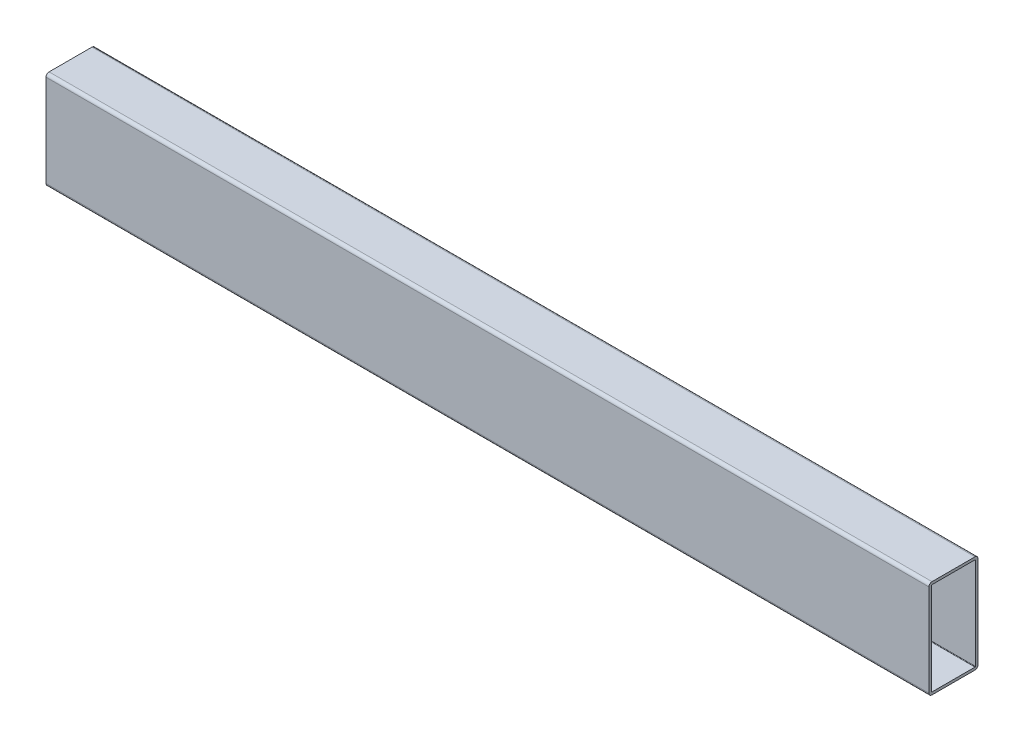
SolidWorks part; units mm, degrees
ref_plane "Front Plane" through (0, 0, 0) normal (0, 0, 1) x (1, 0, 0)
ref_plane "Top Plane" through (0, 0, 0) normal (0, 1, 0) x (1, 0, 0)
ref_plane "Right Plane" through (0, 0, 0) normal (1, 0, 0) x (0, 0, -1)
sketch "Sketch1" plane through (0, 0, 0) normal (1, 0, 0) x (0, 0, -1)
  line L0 (-5.373, 3.898) -> (16.852, 3.898)
  line L1 (-5.373, 5.2442) -> (16.852, 5.2442)
  line L2 (-6.9605, 3.6567) -> (-6.9605, -43.9683)
  line L3 (-5.373, -45.5558) -> (16.852, -45.5558)
  line L4 (18.4395, 3.6567) -> (18.4395, -43.9683)
  line L5 (17.0933, 3.6567) -> (17.0933, -43.9683)
  line L6 (-5.373, -44.2096) -> (16.852, -44.2096)
  line L7 (-5.6143, 3.6567) -> (-5.6143, -43.9683)
  arc A0 (16.852, 5.2442) -> (18.4395, 3.6567) centre (16.852, 3.6567) cw
  arc A1 (-6.9605, 3.6567) -> (-5.373, 5.2442) centre (-5.373, 3.6567) cw
  arc A2 (-5.373, -45.5558) -> (-6.9605, -43.9683) centre (-5.373, -43.9683) cw
  arc A3 (18.4395, -43.9683) -> (16.852, -45.5558) centre (16.852, -43.9683) cw
  arc A4 (16.852, 3.898) -> (17.0933, 3.6567) centre (16.852, 3.6567) cw
  arc A5 (17.0933, -43.9683) -> (16.852, -44.2096) centre (16.852, -43.9683) cw
  arc A6 (-5.373, -44.2096) -> (-5.6143, -43.9683) centre (-5.373, -43.9683) cw
  arc A7 (-5.6143, 3.6567) -> (-5.373, 3.898) centre (-5.373, 3.6567) cw
  point P6 (18.4395, 5.2442)
  point P9 (-6.9605, 5.2442)
  point P14 (18.4395, -45.5558)
  dimension "D3" = 1.5875
  dimension "D1" = 25.4
  dimension "D2" = 50.8
  dimension "D4" = 1.3462
extrude "Extrude1" add sketch "Sketch1" along normal blind 457.2
